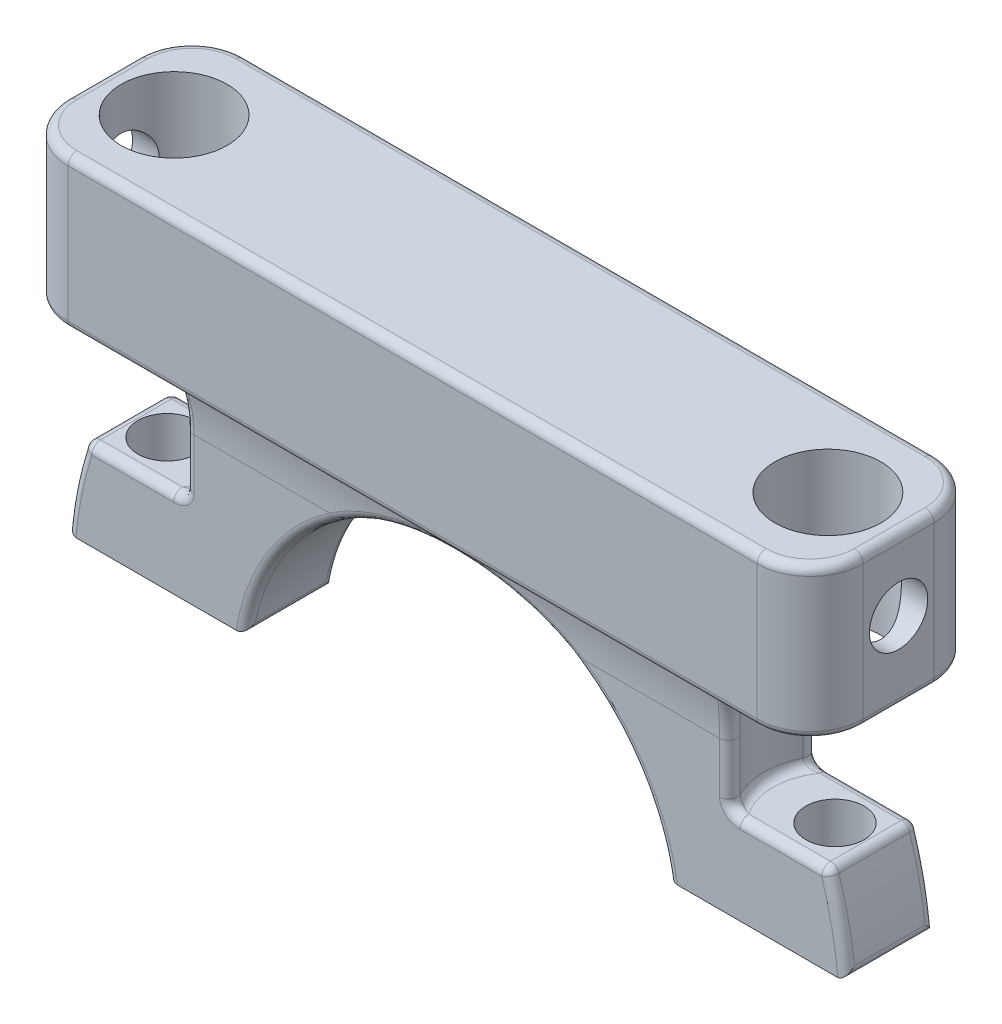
SolidWorks part; units mm, degrees
ref_plane "Front Plane" through (0, 0, 0) normal (0, 0, 1) x (1, 0, 0)
ref_plane "Top Plane" through (0, 0, 0) normal (0, 1, 0) x (1, 0, 0)
ref_plane "Right Plane" through (0, 0, 0) normal (1, 0, 0) x (0, 0, -1)
sketch "Sketch1" plane through (0, 0, 0) normal (0, 0, 1) x (1, 0, 0)
  line L0 (55, 0) -> (-55, 0) construction
  line L1 (-11.9843, 2) -> (-11.9843, 0) construction
  line L2 (11.9843, 2) -> (11.9843, 0) construction
  line L3 (-11.9843, 2) -> (-22.0595, 2)
  line L4 (11.9843, 2) -> (22.0595, 2)
  circle A0 centre (0, 0) radius 12.15 construction
  arc A1 (-11.9843, 2) -> (11.9843, 2) centre (0, 0) cw
  circle A2 centre (0, 0) radius 22.15 construction
  arc A3 (-22.0595, 2) -> (22.0595, 2) centre (0, 0) cw
  dimension "D1" = 24.3
  dimension "D2" = 10
  dimension "D3" = 2
extrude "Boss-Extrude1" add sketch "Sketch1" along normal mid plane 5
sketch "Sketch2" plane through (0, 2, 0) normal (0, -1, 0) x (1, 0, 0)
  line L0 (11.0825, 0) -> (-11.0825, 0) construction
  line L1 (0, -2.75) -> (0, 2.75) construction
  circle A0 centre (-18.9, 0) radius 1.65
  dimension "D1" = 3.3
  dimension "D2" = 18.9
extrude "Cut-Extrude1" cut sketch "Sketch2" against normal through all both
ref_plane "Plane1" through (0, 7, 0) normal (0, 1, 0) x (1, 0, 0)
sketch "Sketch3" plane through (0, 7, 0) normal (0, 1, 0) x (1, 0, 0)
  circle A0 centre (-18.9, 0) radius 4
  dimension "D1" = 8
extrude "Cut-Extrude2" cut sketch "Sketch3" along normal through all
mirror "Mirror1" about plane through (0, 0, 0) normal (1, 0, 0) of "Cut-Extrude2", "Cut-Extrude1"
ref_plane "Plane2" through (0, 17, 0) normal (0, 1, 0) x (1, 0, 0)
sketch "Sketch4" plane through (0, 17, 0) normal (0, 1, 0) x (1, 0, 0)
  line L0 (-11.0825, 0) -> (11.0825, 0) construction
  line L1 (-19.5, -5) -> (19.5, -5)
  line L2 (-22.5, -2) -> (-22.5, 2)
  line L3 (-19.5, 5) -> (19.5, 5)
  line L4 (22.5, -2) -> (22.5, 2)
  line L5 (-22.5, -5) -> (22.5, 5) construction
  line L6 (-22.5, 5) -> (22.5, -5) construction
  line L7 (0, 6.8701) -> (0, -9.1369) construction
  line L8 (0, -2.75) -> (0, 2.75) construction
  circle A0 centre (18.5, 0) radius 3
  circle A1 centre (-18.5, 0) radius 3
  arc A2 (-19.5, -5) -> (-22.5, -2) centre (-19.5, -2) cw
  arc A3 (19.5, -5) -> (22.5, -2) centre (19.5, -2) ccw
  arc A4 (19.5, 5) -> (22.5, 2) centre (19.5, 2) cw
  arc A5 (-22.5, 2) -> (-19.5, 5) centre (-19.5, 2) cw
  point P0 (0, 0)
  dimension "D3" = 6
  dimension "D4" = 45
  dimension "D5" = 3
  dimension "D1" = 10
  dimension "D2" = 37
extrude "Boss-Extrude2" add sketch "Sketch4" along normal blind 6
fillet "Fillet1" radius 10 2 edges at (0, 17, -2.5) (0, 17, 2.5)
sketch "Sketch5" plane through (0, 17, 0) normal (0, 1, 0) x (1, 0, 0)
  line L4 (-19.5, -5) -> (19.5, -5)
  line L5 (22.5, -2) -> (22.5, 2)
  line L6 (19.5, 5) -> (-19.5, 5)
  line L7 (-22.5, 2) -> (-22.5, -2)
  line L8 (-19.5, -5) -> (19.5, -5)
  line L9 (22.5, -2) -> (22.5, 2)
  line L10 (19.5, 5) -> (-19.5, 5)
  line L11 (-22.5, 2) -> (-22.5, -2)
  circle A0 centre (-18.5, 0) radius 3
  circle A1 centre (18.5, 0) radius 3
  circle A2 centre (-18.5, 0) radius 3 construction
  circle A3 centre (18.5, 0) radius 3 construction
  arc A4 (-22.5, -2) -> (-19.5, -5) centre (-19.5, -2) ccw
  arc A5 (19.5, -5) -> (22.5, -2) centre (19.5, -2) ccw
  arc A6 (22.5, 2) -> (19.5, 5) centre (19.5, 2) ccw
  arc A7 (-19.5, 5) -> (-22.5, 2) centre (-19.5, 2) ccw
  arc A8 (-22.5, -2) -> (-19.5, -5) centre (-19.5, -2) ccw
  arc A9 (19.5, -5) -> (22.5, -2) centre (19.5, -2) ccw
  arc A10 (22.5, 2) -> (19.5, 5) centre (19.5, 2) ccw
  arc A11 (-19.5, 5) -> (-22.5, 2) centre (-19.5, 2) ccw
  dimension "D1" = 0
extrude "Boss-Extrude3" add sketch "Sketch5" against normal blind 2.5 contours L10 A11 L11 A8 L8 A9 L9 A10 A0 A1
fillet "Fillet4" radius 0.4 10 edges at (0, 14.5, 5) (-21.6213, 14.5, 4.1213) (-22.5, 14.5, 0) (-21.6213, 14.5, -4.1213) (0, 14.5, -5) (21.6213, 14.5, -4.1213) (22.5, 14.5, 0) (21.6213, 14.5, 4.1213) (14.9, 14.5, 0) (-14.9, 14.5, 0)
fillet "Fillet5" radius 2 2 edges at (0, 14.5, -3.3856) (0, 14.5, 3.3856)
sketch "Sketch6" plane through (-22.5, 0, 0) normal (-1, 0, 0) x (0, 0, 1)
  line L0 (-5, 18.95) -> (5, 18.95) construction
  line L1 (-5, 23) -> (-5, 14.9) construction
  line L2 (5, 23) -> (5, 14.9) construction
  circle A0 centre (0, 18.95) radius 1.65
  dimension "D1" = 3.3
extrude "Cut-Extrude3" cut sketch "Sketch6" against normal blind 5
mirror "Mirror2" about plane through (0, 0, 0) normal (1, 0, 0) of "Cut-Extrude3"
fillet "Fillet6" radius 0.5 42 edges at (-21.6818, 4.5302, 2.5) (-22.0595, 2, 0) (-21.6818, 4.5302, -2.5) (-21.0148, 7, 0) (21.6818, 4.5302, -2.5) (22.0595, 2, 0) (21.6818, 4.5302, 2.5) (21.0148, 7, 0) (-11.9843, 2, 0) (-10.0603, 6.8127, 2.5) (-1.5313, 12.0531, 2.64) (10.0603, 6.8127, 2.5) (11.9843, 2, 0) (10.0603, 6.8127, -2.5) (1.5313, 12.0531, -2.64) (-10.0603, 6.8127, -2.5) (14.9, 7, 0) (-14.9, 7, 0) (-16.3222, 13.5144, 3.0586) (-16.5575, 13.7784, -3.2423) (16.3222, 13.5144, -3.0586) (16.5575, 13.7784, 3.2423) (-15.7775, 8.6928, 2.5) (-15.7775, 8.6928, -2.5) (15.7775, 8.6928, -2.5) (15.7775, 8.6928, 2.5) (-18.3962, 7, 2.5) (-18.3962, 7, -2.5) (18.3962, 7, -2.5) (18.3962, 7, 2.5) (21.6213, 23, -4.1213) (22.5, 23, 0) (21.6213, 23, 4.1213) (0, 23, 5) (-21.6213, 23, 4.1213) (-22.5, 23, 0) (-21.6213, 23, -4.1213) (0, 23, -5)
fillet "Fillet7" radius 0.11 8 edges at (16.7443, 14.5, -3.7416) (16.7443, 14.5, 3.7416) (-16.7443, 14.5, 3.7416) (-16.7443, 14.5, -3.7416)
